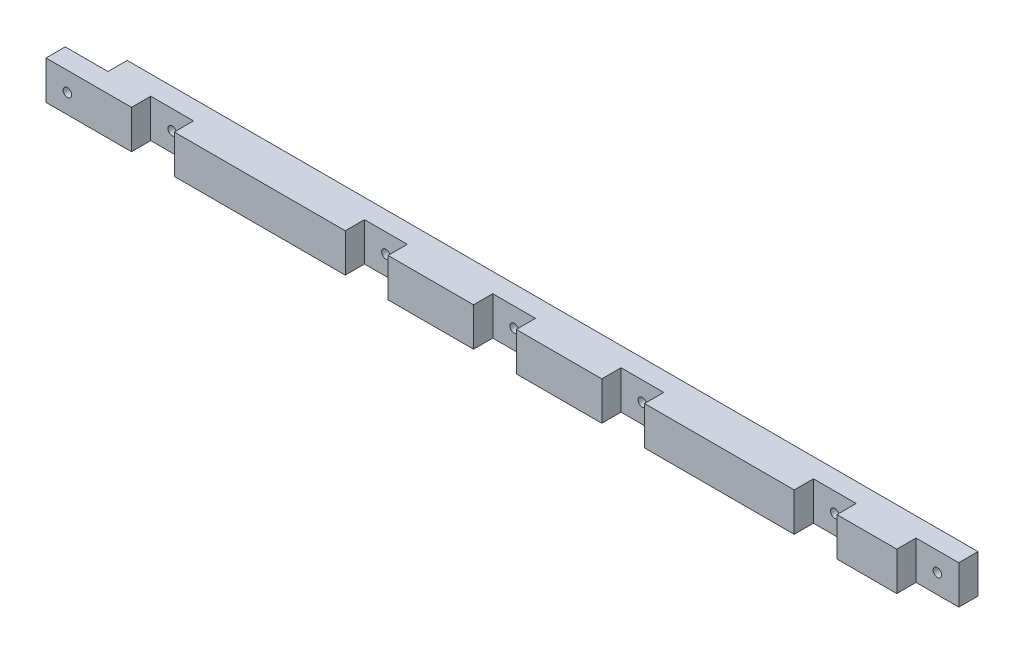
SolidWorks part; units mm, degrees
ref_plane "Plan de face" through (0, 0, 0) normal (0, 0, 1) x (1, 0, 0)
ref_plane "Plan de dessus" through (0, 0, 0) normal (0, 1, 0) x (1, 0, 0)
ref_plane "Plan de droite" through (0, 0, 0) normal (1, 0, 0) x (0, 0, -1)
sketch "Esquisse1" plane through (0, 0, 0) normal (0, 0, 1) x (1, 0, 0)
  line L1 (0, 0) -> (209, 0)
  line L2 (0, 0) -> (0, 9)
  line L3 (0, 9) -> (209, 9)
  line L4 (209, 0) -> (209, 9)
  dimension "D1" = 209
  dimension "D2" = 9
extrude "Extrusion1" add sketch "Esquisse1" along normal blind 9
sketch "Esquisse2" plane through (0, 0, 9) normal (0, 0, 1) x (1, 0, 0)
  line L0 (209, 9) -> (0, 9) construction
  line L1 (209, 0) -> (199, 0)
  line L2 (209, 0) -> (209, 9)
  line L3 (209, 9) -> (199, 9)
  line L4 (199, 0) -> (199, 9)
  dimension "D1" = 10
extrude "Enlèv. mat.-Extru.1" cut sketch "Esquisse2" against normal blind 4.5
sketch "Esquisse3" plane through (0, 0, 4.5) normal (0, 0, 1) x (1, 0, 0)
  line L0 (199, 9) -> (199, 0) construction
  line L1 (199, 0) -> (209, 0) construction
  circle A0 centre (204, 4.5) radius 1
  dimension "D3" = 2
  dimension "D1" = 5
  dimension "D2" = 4.5
extrude "Enlèv. mat.-Extru.2" cut sketch "Esquisse3" against normal blind 4.5
sketch "Esquisse4" plane through (0, 0, 9) normal (0, 0, 1) x (1, 0, 0)
  line L0 (0, 0) -> (199, 0) construction
  line L1 (185, 0) -> (175, 0)
  line L2 (185, 0) -> (185, 9)
  line L3 (185, 9) -> (175, 9)
  line L4 (175, 0) -> (175, 9)
  line L5 (199, 9) -> (0, 9) construction
  dimension "D1" = 10
  dimension "D2" = 14
extrude "Enlèv. mat.-Extru.3" cut sketch "Esquisse4" against normal blind 4.5
sketch "Esquisse5" plane through (0, 0, 4.5) normal (0, 0, 1) x (1, 0, 0)
  line L0 (175, 9) -> (175, 0) construction
  line L1 (175, 0) -> (185, 0) construction
  circle A0 centre (180, 4.5) radius 1
  dimension "D3" = 2
  dimension "D1" = 5
  dimension "D2" = 4.5
extrude "Enlèv. mat.-Extru.4" cut sketch "Esquisse5" against normal blind 4.5
sketch "Esquisse6" plane through (0, 0, 9) normal (0, 0, 1) x (1, 0, 0)
  line L0 (175, 9) -> (0, 9) construction
  line L1 (140, 9) -> (130, 9)
  line L2 (140, 9) -> (140, 0)
  line L3 (140, 0) -> (130, 0)
  line L4 (130, 9) -> (130, 0)
  line L5 (0, 0) -> (175, 0) construction
  dimension "D1" = 10
  dimension "D2" = 35
extrude "Enlèv. mat.-Extru.5" cut sketch "Esquisse6" against normal blind 4.5
sketch "Esquisse7" plane through (0, 0, 4.5) normal (0, 0, 1) x (1, 0, 0)
  line L0 (130, 9) -> (130, 0) construction
  line L1 (130, 0) -> (140, 0) construction
  circle A0 centre (135, 4.5) radius 1
  dimension "D3" = 2
  dimension "D1" = 5
  dimension "D2" = 4.5
extrude "Enlèv. mat.-Extru.6" cut sketch "Esquisse7" against normal blind 4.5
sketch "Esquisse8" plane through (0, 0, 9) normal (0, 0, 1) x (1, 0, 0)
  line L0 (130, 9) -> (0, 9) construction
  line L1 (110, 9) -> (100, 9)
  line L2 (110, 9) -> (110, 0)
  line L3 (110, 0) -> (100, 0)
  line L4 (100, 9) -> (100, 0)
  line L5 (0, 0) -> (130, 0) construction
  dimension "D1" = 10
  dimension "D2" = 20
extrude "Enlèv. mat.-Extru.7" cut sketch "Esquisse8" against normal blind 4.5
sketch "Esquisse9" plane through (0, 0, 4.5) normal (0, 0, 1) x (1, 0, 0)
  line L0 (100, 9) -> (100, 0) construction
  line L1 (100, 0) -> (110, 0) construction
  circle A0 centre (105, 4.5) radius 1
  dimension "D3" = 2
  dimension "D1" = 5
  dimension "D2" = 4.5
extrude "Enlèv. mat.-Extru.8" cut sketch "Esquisse9" against normal blind 4.5
sketch "Esquisse10" plane through (0, 0, 9) normal (0, 0, 1) x (1, 0, 0)
  line L0 (0, 0) -> (100, 0) construction
  line L1 (80, 0) -> (70, 0)
  line L2 (80, 0) -> (80, 9)
  line L3 (80, 9) -> (70, 9)
  line L4 (70, 0) -> (70, 9)
  line L5 (100, 9) -> (0, 9) construction
  dimension "D1" = 10
  dimension "D2" = 20
extrude "Enlèv. mat.-Extru.9" cut sketch "Esquisse10" against normal blind 4.5
sketch "Esquisse11" plane through (0, 0, 4.5) normal (0, 0, 1) x (1, 0, 0)
  line L0 (70, 9) -> (70, 0) construction
  line L1 (70, 0) -> (80, 0) construction
  circle A0 centre (75, 4.5) radius 1
  dimension "D3" = 2
  dimension "D1" = 5
  dimension "D2" = 4.5
extrude "Enlèv. mat.-Extru.10" cut sketch "Esquisse11" against normal blind 4.5
sketch "Esquisse12" plane through (0, 0, 9) normal (0, 0, 1) x (1, 0, 0)
  line L0 (0, 0) -> (70, 0) construction
  line L1 (30, 0) -> (20, 0)
  line L2 (30, 0) -> (30, 9)
  line L3 (30, 9) -> (20, 9)
  line L4 (20, 0) -> (20, 9)
  line L5 (70, 9) -> (0, 9) construction
  dimension "D1" = 10
  dimension "D2" = 40
extrude "Enlèv. mat.-Extru.11" cut sketch "Esquisse12" against normal blind 4.5
sketch "Esquisse13" plane through (0, 0, 4.5) normal (0, 0, 1) x (1, 0, 0)
  line L0 (20, 9) -> (20, 0) construction
  line L1 (30, 9) -> (20, 9) construction
  circle A0 centre (25, 4.5) radius 1
  dimension "D3" = 2
  dimension "D1" = 5
  dimension "D2" = 4.5
extrude "Enlèv. mat.-Extru.12" cut sketch "Esquisse13" against normal blind 4.5
sketch "Esquisse14" plane through (0, 0, 0) normal (0, 0, -1) x (-1, 0, 0)
  line L0 (-209, 9) -> (0, 9) construction
  line L1 (0, 0) -> (-10, 0)
  line L2 (0, 0) -> (0, 9)
  line L3 (0, 9) -> (-10, 9)
  line L4 (-10, 0) -> (-10, 9)
  dimension "D1" = 10
extrude "Enlèv. mat.-Extru.13" cut sketch "Esquisse14" against normal blind 4.5
sketch "Esquisse15" plane through (0, 0, 4.5) normal (0, 0, -1) x (-1, 0, 0)
  line L0 (0, 0) -> (0, 9) construction
  line L1 (-10, 0) -> (0, 0) construction
  circle A0 centre (-5, 4.5) radius 1
  dimension "D3" = 2
  dimension "D1" = 5
  dimension "D2" = 4.5
extrude "Enlèv. mat.-Extru.14" cut sketch "Esquisse15" against normal blind 4.5
